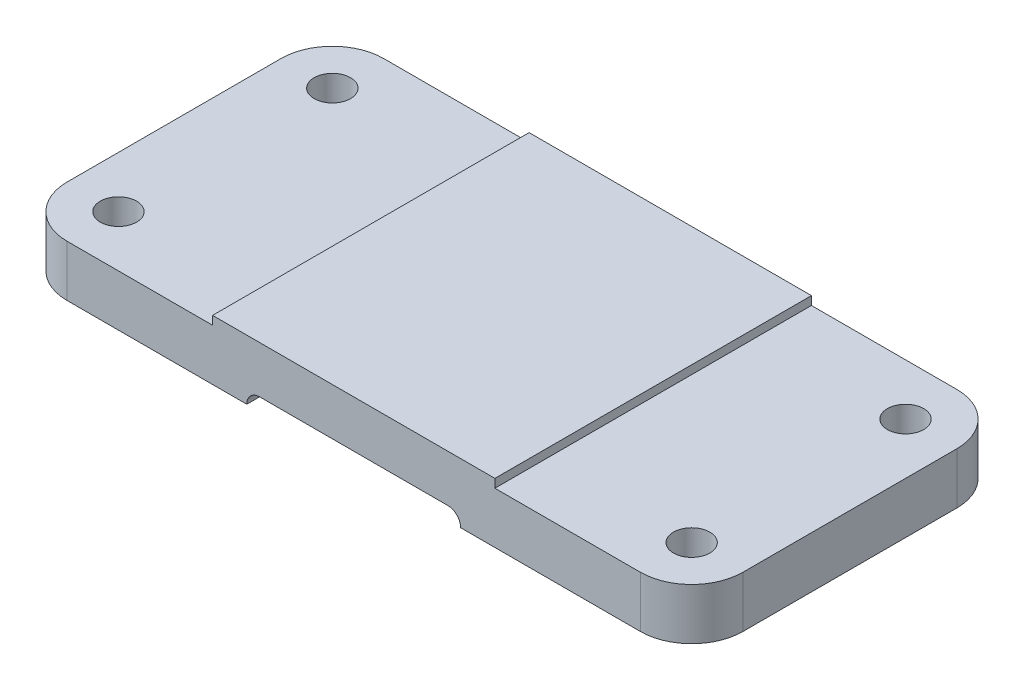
SolidWorks part; units mm, degrees
ref_plane "Front Plane" through (0, 0, 0) normal (0, 0, 1) x (1, 0, 0)
ref_plane "Top Plane" through (0, 0, 0) normal (0, 1, 0) x (1, 0, 0)
ref_plane "Right Plane" through (0, 0, 0) normal (1, 0, 0) x (0, 0, -1)
sketch "Sketch1" plane through (0, 0, 0) normal (0, 0, 1) x (1, 0, 0)
  line L0 (-8.6178, -8.1939) -> (35.3822, -8.1939)
  line L1 (-19.6178, 2.8061) -> (46.3822, 2.8061)
  line L2 (-19.6178, 2.8061) -> (-19.6178, 0.8061)
  line L4 (46.3822, 2.8061) -> (46.3822, 0.8061)
  line L5 (-19.6178, 0.8061) -> (-65.6178, 0.8061)
  line L7 (-11.6178, -11.1939) -> (-65.6178, -11.1939)
  line L8 (-65.6178, 0.8061) -> (-65.6178, -11.1939)
  line L9 (46.3822, 0.8061) -> (92.3822, 0.8061)
  line L11 (38.3822, -11.1939) -> (92.3822, -11.1939)
  line L12 (92.3822, 0.8061) -> (92.3822, -11.1939)
  arc A0 (38.3822, -11.1939) -> (35.3822, -8.1939) centre (35.3822, -11.1939) ccw
  arc A1 (-8.6178, -8.1939) -> (-11.6178, -11.1939) centre (-8.6178, -11.1939) ccw
extrude "Boss-Extrude1" add sketch "Sketch1" along normal blind 74
fillet "Fillet1" radius 12 4 edges at (92.3822, -5.1939, 0) (92.3822, -5.1939, 74) (-65.6178, -5.1939, 74) (-65.6178, -5.1939, 0)
sketch "Sketch6" plane through (0, 0.8061, 0) normal (0, 1, 0) x (1, 0, 0)
  line L0 (80.3822, -109.8533) -> (80.3822, 21.0306) construction
  line L1 (122.7289, -62) -> (-108.2091, -62) construction
  line L2 (122.0295, -12) -> (-108.9907, -12) construction
  line L3 (-53.6178, -102.5486) -> (-53.6178, 18.3631) construction
  line L4 (46.3822, -74) -> (46.3822, 0) construction
  line L6 (-19.6178, -74) -> (-19.6178, 0) construction
  line L9 (80.3822, -74) -> (46.3822, -74) construction
  circle A0 centre (80.3822, -62) radius 6
  circle A1 centre (80.3822, -12) radius 6
  circle A2 centre (-53.6178, -62) radius 6
  circle A3 centre (-53.6178, -12) radius 6
  dimension "D1" = 12
  dimension "D2" = 12
  dimension "D3" = 12
  dimension "D4" = 12
  dimension "D5" = 34
  dimension "D6" = 34
  dimension "D7" = 50
  dimension "D8" = 12
hole_wizard "M10 Tapped Hole1" positions "3DSketch2" profile "Sketch7" tap size "M10" standard "AS"
sketch3d "3DSketch2"
  point P0 (80.3822, 0.8061, 62)
  point P3 (80.3822, 0.8061, 12)
  point P6 (-53.6178, 0.8061, 12)
  point P9 (-53.6178, 0.8061, 62)
sketch "Sketch7" plane through (80.3822, 0.8061, 62) normal (1, 0, 0) x (0, 0, 1)
  line L0 (0, 0) -> (0, 27.0537)
  line L1 (0, 27.0537) -> (4.25, 24.5)
  line L2 (4.25, 24.5) -> (4.25, 0)
  line L5 (4.25, 0) -> (0, 0)
  line L10 (0, 27.0537) -> (-4.25, 24.5) construction
  line L11 (0, -6.35) -> (0, 107.95) construction
  dimension "Tap Drill Dia." = 8.5
  dimension "Tap Drill Depth" = 24.5
  dimension "Drill Angle" = 118
equation "\"D4@Sketch1\"=\"D3@Sketch1\""
equation "\"D5@Sketch1\"=\"D2@Sketch1\""
